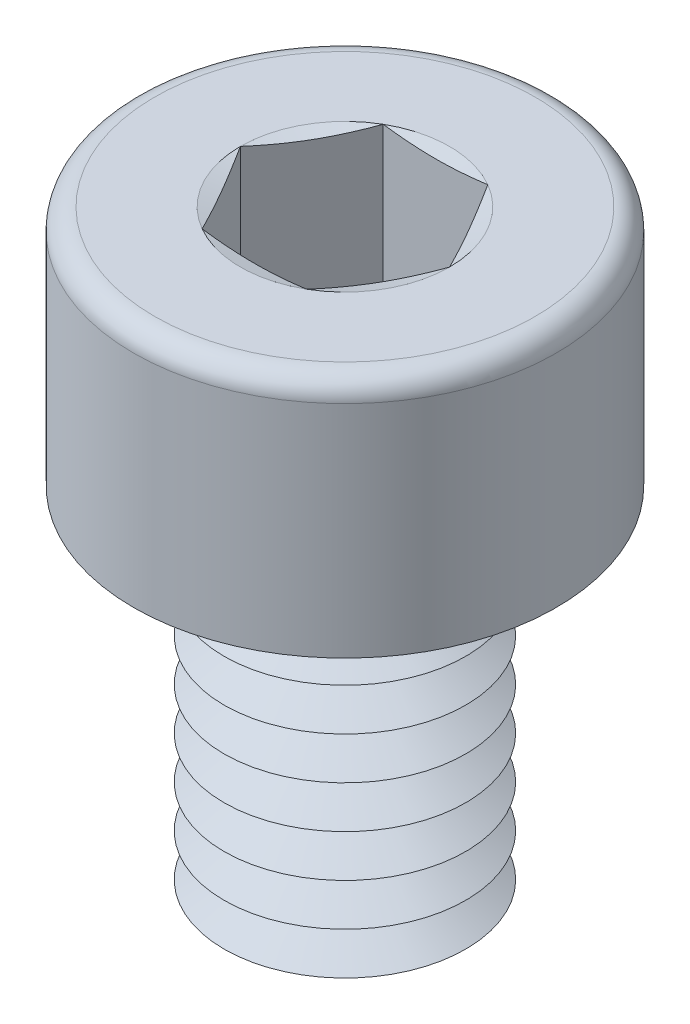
SolidWorks part; units mm, degrees
ref_plane "Front Plane" through (0, 0, 0) normal (0, 0, 1) x (1, 0, 0)
ref_plane "Top Plane" through (0, 0, 0) normal (0, 1, 0) x (1, 0, 0)
ref_plane "Right Plane" through (0, 0, 0) normal (1, 0, 0) x (0, 0, -1)
sketch "Sketch1" plane through (0, 0, 0) normal (0, 1, 0) x (1, 0, 0)
  circle A0 centre (0, 0) radius 2
  dimension "D1" = 4
extrude "Extrude1" add sketch "Sketch1" along normal blind 6
sketch "Sketch2" plane through (0, 6, 0) normal (0, 1, 0) x (1, 0, 0)
  circle A0 centre (0, 0) radius 3.5
  dimension "D1" = 7
extrude "Extrude2" add sketch "Sketch2" along normal blind 4
sketch "Sketch3" plane through (0, 10, 0) normal (0, 1, 0) x (1, 0, 0)
  line L1 (0.866, 1.5) -> (-0.866, 1.5)
  line L2 (-0.866, 1.5) -> (-1.7321, 0)
  line L3 (-1.7321, 0) -> (-0.866, -1.5)
  line L4 (-0.866, -1.5) -> (0.866, -1.5)
  line L5 (0.866, -1.5) -> (1.7321, 0)
  line L6 (1.7321, 0) -> (0.866, 1.5)
  circle A0 centre (0, 0) radius 1.5 construction
  dimension "D1" = 3
extrude "Extrude3" cut sketch "Sketch3" against normal blind 3
fillet "Fillet1" radius 0.35 1 edges at (0, 10, 3.5)
sketch "Sketch4" plane through (0, 0, 0) normal (1, 0, 0) x (0, 0, -1)
  line L0 (-1.5, 7) -> (0, 7)
  line L1 (0, 7) -> (0, 6.134)
  line L2 (0, 6.134) -> (-1.5, 7)
  dimension "D1" = 30
revolve "Cut-Revolve1" cut sketch "Sketch4" angle 360 about L1
sketch "Sketch5" plane through (0, 0, 0) normal (0, 0, 1) x (1, 0, 0)
  line L0 (-2, 0.35) -> (-2, -0.35)
  line L1 (-2, 6) -> (-2, 0) construction
  line L2 (-2, -0.35) -> (-1.3938, 0)
  line L3 (-2, 0) -> (2, 0) construction
  line L4 (-1.3938, 0) -> (-2, 0.35)
  dimension "D1" = 0.7
revolve "Cut-Revolve2" cut sketch "Sketch5" angle 360 about axis through (0, 6, 0) along (0, -1, 0)
pattern_linear "LPattern1" count 9 spacing 0.7 along (0, 1, 0) of "Cut-Revolve2"
sketch "Sketch6" plane through (0, 10, 0) normal (0, 1, 0) x (1, 0, 0)
  circle A0 centre (0, 0) radius 1.7321
extrude "Extrude4" cut sketch "Sketch6" against normal through all draft 75
